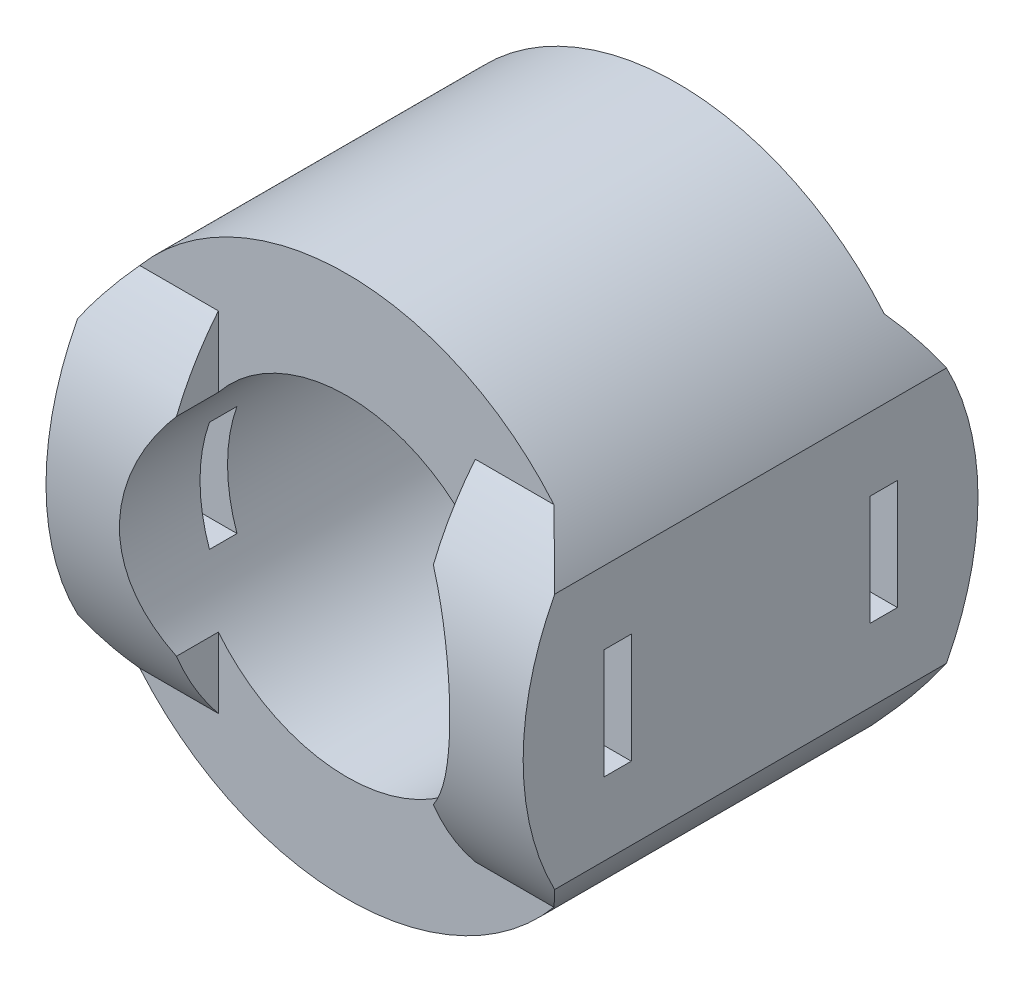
SolidWorks part; units mm, degrees
ref_plane "Plan1" through (0, 0, 0) normal (0, 0, 1) x (1, 0, 0)
ref_plane "Plan2" through (0, 0, 0) normal (0, 1, 0) x (1, 0, 0)
ref_plane "Plan3" through (0, 0, 0) normal (1, 0, 0) x (0, 0, -1)
sketch "Esquisse1" plane through (0, 0, 0) normal (0, 0, 1) x (1, 0, 0)
  line L0 (-26, 13.9374) -> (-26, -13.9374)
  line L1 (26, 13.9374) -> (26, -13.9374)
  circle A0 centre (0, 0) radius 18
  arc A1 (26, 13.9374) -> (-26, 13.9374) centre (0, 0) ccw
  arc A2 (-26, -13.9374) -> (26, -13.9374) centre (0, 0) ccw
  dimension "D1" = 36
  dimension "D2" = 59
  dimension "D3" = 52
extrude "Base-Extrusion" add sketch "Esquisse1" along normal blind 36
sketch "Esquisse2" plane through (26, 0, 0) normal (1, 0, 0) x (0, 0, -1)
  line L0 (-36, -19) -> (-36, 19)
  line L1 (-36, -13.9374) -> (-36, -29.5) construction
  line L3 (-36, 0) -> (0, 0) construction
  line L4 (0, -19) -> (0, 19)
  arc A0 (-36, 19) -> (-36, -19) centre (-12.7836, 0) ccw
  arc A1 (0, -19) -> (0, 19) centre (-23.2164, 0) ccw
  dimension "D1" = 30
  dimension "D2" = 38
extrude "Boss.-Extru.1" add sketch "Esquisse2" along normal up to surface (52 mm away)
sketch "Esquisse3" plane through (0, 0, 36) normal (0, 0, 1) x (1, 0, 0)
  line L0 (14, -11.3137) -> (14, -25.9663)
  line L1 (-14, 25.9663) -> (14, 25.9663)
  line L2 (-14, 25.9663) -> (-14, 11.3137)
  line L3 (-14, -25.9663) -> (14, -25.9663)
  line L4 (14, 25.9663) -> (14, 11.3137)
  line L5 (-14, -11.3137) -> (-14, -25.9663)
  circle A0 centre (0, 0) radius 18 construction
  arc A1 (-14, 11.3137) -> (-14, -11.3137) centre (0, 0) ccw
  arc A2 (22.5666, 19) -> (-22.5666, 19) centre (0, 0) ccw construction
  arc A4 (-22.5666, -19) -> (22.5666, -19) centre (0, 0) ccw construction
  arc A5 (14, -11.3137) -> (14, 11.3137) centre (0, 0) ccw
  dimension "D1" = 14
extrude "Enlèv. mat.-Extru.2" cut sketch "Esquisse3" along normal through all
sketch "Esquisse5" plane through (0, 0, 0) normal (0, 0, 1) x (1, 0, 0)
  line L0 (14, 19) -> (14, 11.3137) construction
  line L1 (14, 25.9663) -> (-14, 25.9663)
  line L2 (14, 25.9663) -> (14, 11.3137)
  line L3 (14, -25.9663) -> (-14, -25.9663)
  line L4 (-14, 25.9663) -> (-14, 11.3137)
  line L5 (-14, 11.3137) -> (-14, 19) construction
  line L6 (-14, -11.3137) -> (-14, -25.9663)
  line L7 (14, -11.3137) -> (14, -25.9663)
  arc A0 (-22.5666, -19) -> (22.5666, -19) centre (0, 0) ccw construction
  circle A1 centre (0, 0) radius 18
  arc A2 (14, -11.3137) -> (14, 11.3137) centre (0, 0) ccw
  arc A3 (22.5666, 19) -> (-22.5666, 19) centre (0, 0) ccw construction
  arc A4 (-14, 11.3137) -> (-14, -11.3137) centre (0, 0) ccw
  dimension "D1" = 0
extrude "Enlèv. mat.-Extru.4" cut sketch "Esquisse5" against normal through all
sketch "Esquisse6" plane through (0, 0, 0) normal (0, 0, -1) x (-1, 0, 0)
  circle A0 centre (0, 0) radius 29.5
  circle A1 centre (0, 0) radius 32.2025
  arc A3 (22.5666, 19) -> (-22.5666, 19) centre (0, 0) ccw construction
extrude "Enlèv. mat.-Extru.7" cut sketch "Esquisse6" against normal through all and the other way through all
sketch "Esquisse7" plane through (-26, 0, 0) normal (-1, 0, 0) x (0, 0, 1)
  line L0 (34, 0) -> (2, 0) construction
  line L1 (34, 6) -> (31, 6)
  line L2 (34, 6) -> (34, -6)
  line L3 (34, -6) -> (31, -6)
  line L4 (31, 6) -> (31, -6)
  line L5 (5, 6) -> (2, 6)
  line L6 (5, 6) -> (5, -6)
  line L7 (5, -6) -> (2, -6)
  line L8 (2, 6) -> (2, -6)
  line L9 (36, 0) -> (0, 0) construction
  line L10 (31, 0) -> (42.7836, 0) construction
  line L12 (5, 0) -> (-6.7836, 0) construction
  arc A0 (-3.3496, 13.9374) -> (-3.3496, -13.9374) centre (23.2164, 0) ccw construction
  arc A1 (39.3496, -13.9374) -> (39.3496, 13.9374) centre (12.7836, 0) ccw construction
  dimension "D1" = 29
  dimension "D2" = 12
  dimension "D3" = 3
extrude "Enlèv. mat.-Extru.8" cut sketch "Esquisse7" against normal through all
